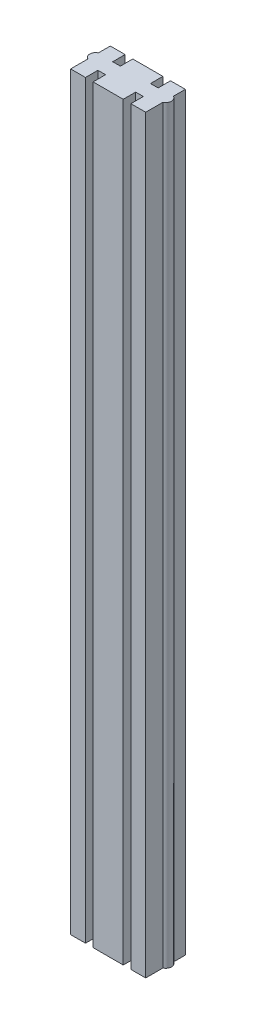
SolidWorks part; units mm, degrees
ref_plane "Front Plane" through (0, 0, 0) normal (0, 0, 1) x (1, 0, 0)
ref_plane "Top Plane" through (0, 0, 0) normal (0, 1, 0) x (1, 0, 0)
ref_plane "Right Plane" through (0, 0, 0) normal (1, 0, 0) x (0, 0, -1)
sketch "Sketch1" plane through (0, 0, 0) normal (0, 1, 0) x (1, 0, 0)
  line L0 (0, 21.082) -> (7.874, 21.082) construction
  line L1 (0, 0) -> (7.874, 0)
  line L2 (0, 0) -> (0, 9.1672)
  line L3 (0, 21.082) -> (7.874, 21.082)
  line L4 (39.878, 0) -> (39.878, 9.1672)
  line L5 (7.874, 21.082) -> (7.874, 14.478) construction
  line L6 (7.874, 14.478) -> (11.938, 14.478) construction
  line L7 (11.938, 14.478) -> (11.938, 21.082) construction
  line L8 (19.939, 21.082) -> (19.939, 0) construction
  line L9 (3.979, 10.541) -> (39.878, 10.541) construction
  line L11 (7.874, 21.082) -> (7.874, 14.478)
  line L12 (7.874, 14.478) -> (11.938, 14.478)
  line L13 (11.938, 21.082) -> (11.938, 14.478)
  line L14 (32.004, 14.478) -> (27.94, 14.478)
  line L15 (27.94, 21.082) -> (27.94, 14.478)
  line L17 (32.004, 21.082) -> (32.004, 14.478)
  line L18 (7.874, 6.604) -> (11.938, 6.604)
  line L19 (11.938, 0) -> (11.938, 6.604)
  line L21 (7.874, 0) -> (7.874, 6.604)
  line L22 (32.004, 0) -> (32.004, 6.604)
  line L24 (27.94, 0) -> (27.94, 6.604)
  line L25 (32.004, 6.604) -> (27.94, 6.604)
  line L26 (39.878, 21.082) -> (39.878, 14.986) construction
  line L27 (32.004, 21.082) -> (39.878, 21.082)
  line L28 (38.608, 14.986) -> (38.608, 11.938) construction
  line L29 (32.004, 0) -> (39.878, 0)
  line L30 (39.878, 14.7088) -> (39.878, 21.082)
  line L31 (11.938, 21.082) -> (27.94, 21.082)
  line L32 (11.938, 0) -> (27.94, 0)
  line L33 (0, 14.7088) -> (0, 21.082)
  arc A0 (39.878, 9.1672) -> (39.878, 14.7088) centre (38.608, 11.938) ccw
  arc A1 (0, 9.1672) -> (0, 14.7088) centre (1.27, 11.938) cw
  dimension "D1" = 21.082
  dimension "D2" = 39.878
  dimension "D3" = 7.874
  dimension "D4" = 4.064
  dimension "D5" = 6.604
  dimension "D7" = 1.27
  dimension "D8" = 3.048
extrude "Boss-Extrude1" add sketch "Sketch1" along normal blind 398.4625
